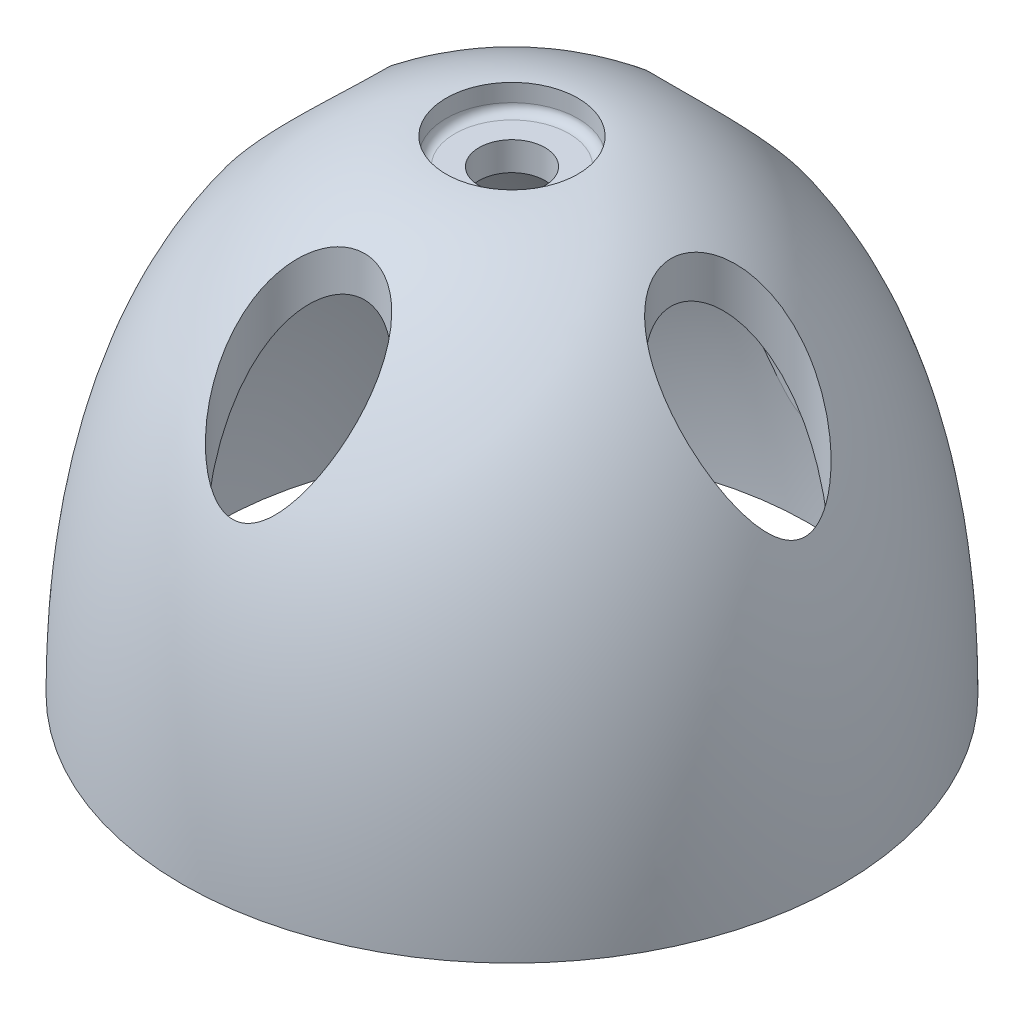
SolidWorks part; units mm, degrees
ref_plane "Спереди" through (0, 0, 0) normal (0, 0, 1) x (1, 0, 0)
ref_plane "Сверху" through (0, 0, 0) normal (0, 1, 0) x (1, 0, 0)
ref_plane "Справа" through (0, 0, 0) normal (1, 0, 0) x (0, 0, -1)
sketch "Эскиз1" plane through (0, 0, 0) normal (0, 0, 1) x (1, 0, 0)
  line L2 (13.5, 0) -> (15, 0)
  line L3 (15, 13.2565) -> (15, -13.2565) construction
  line L4 (3, 20) -> (3, 19.5)
  line L5 (3, 19.5) -> (1.5, 19.5)
  line L6 (1.5, 20.8) -> (2.6, 20.8)
  line L7 (3, 21.2) -> (3, 22)
  line L8 (1.5, 19.5) -> (1.5, 20.8)
  line L9 (3, 20) -> (4.5, 20)
  line L10 (13.5, 11.8984) -> (13.5, -11.8984) construction
  line L11 (0, 0) -> (0, 22) construction
  arc A0 (3, 21.2) -> (2.6, 20.8) centre (2.6, 21.2) cw
  spline S0 degree 3 poles (15, 0) (15, 16.5706) (7.1736, 21.7443) (3, 22) knots 0 0 0 0 1 1 1 1
  spline S1 degree 3 poles (13.5, 0) (13.5, 14.873) (6.2851, 19.9648) (4.5, 20) knots 0 0 0 0 1 1 1 1
  dimension "D6" = 0.4
  dimension "D1" = 15
  dimension "D2" = 22
  dimension "D3" = 13.5
  dimension "D4" = 3
  dimension "D5" = 1.2
  dimension "D7" = 1.5
  dimension "D8" = 20
  dimension "D9" = 0.5
revolve "Повернуть1" add sketch "Эскиз1" angle 360 about L11
sketch "Эскиз3" plane through (0, 0, 0) normal (0, 1, 0) x (1, 0, 0)
  circle A0 centre (0, -9.7174) radius 3
  circle A1 centre (-10, 0.2826) radius 3
  circle A2 centre (0, 10.2826) radius 3
  circle A3 centre (10, 0.2826) radius 3
  point P12 (0, 0.2826)
  dimension "D1" = 6
  dimension "D3" = 10
  dimension "D2" = 4
extrude "Вырез-Вытянуть2" cut sketch "Эскиз3" along normal up to surface (13.2511 mm away)
